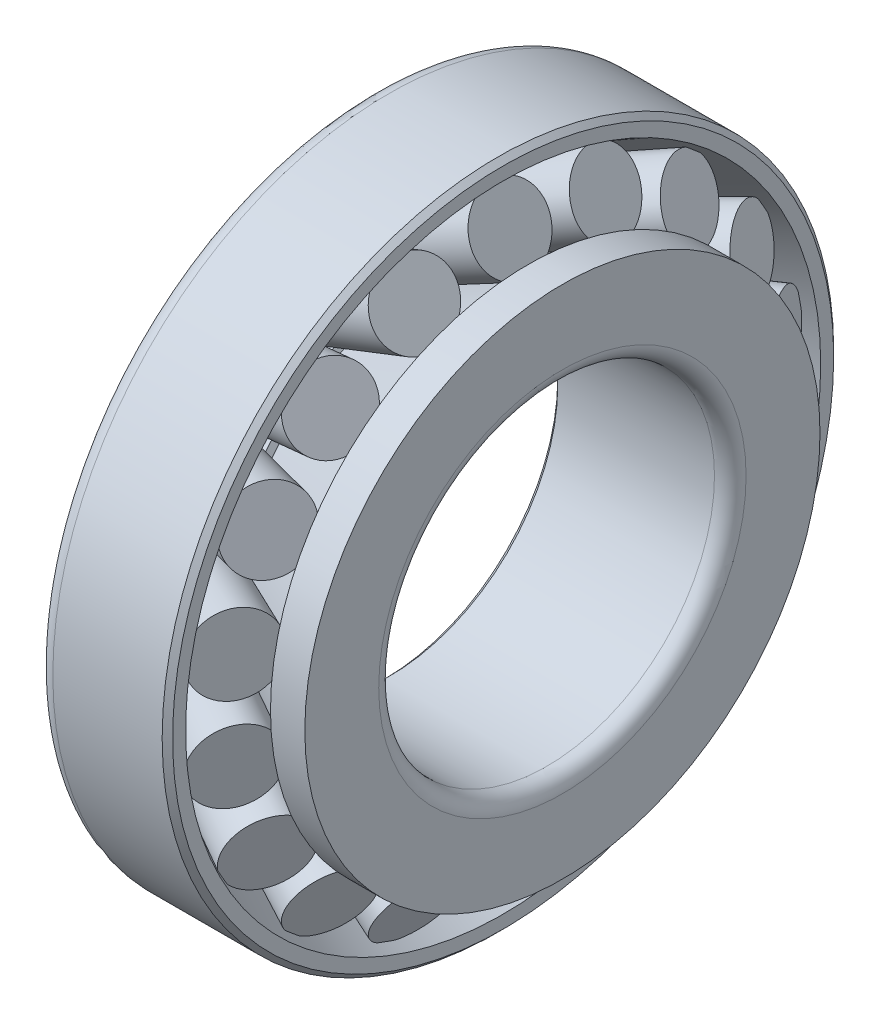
SolidWorks part; units mm, degrees
revolve "OuterRace" add sketch "OutRacSke" angle 360 about L5
sketch "OutRacSke" plane through (0, 0, 0) normal (0, 0, 1) x (1, 0, 0)
  line L0 (-15, 80.39) -> (-48, 62.814)
  line L1 (-48, 62.814) -> (-48, 81)
  line L2 (-44, 85) -> (-16.32, 85)
  line L3 (-16.32, 85) -> (-15, 83.68)
  line L4 (-15, 83.68) -> (-15, 80.39)
  line L5 (-42.5, 0) -> (42.5, 0) construction
  arc A0 (-48, 81) -> (-44, 85) centre (-44, 81) cw
ref_plane "Plane1" through (0, 0, 0) normal (0, 0, 1) x (1, 0, 0)
ref_plane "Plane2" through (0, 0, 0) normal (0, 1, 0) x (1, 0, 0)
ref_plane "Plane3" through (0, 0, 0) normal (1, 0, 0) x (0, 0, -1)
sketch "Clipboard" plane through (0, 0, 0) normal (0, 0, 1) x (1, 0, 0)
  line L0 (0, 0) -> (10, 0) construction
  line L1 (0, 0) -> (119.4793, -38.8212)
  line L2 (0, 0) -> (73.6122, 42.5)
  line L3 (0, 0) -> (147.2243, -85)
  line L4 (0, 0) -> (-29.6819, -1.0365)
  line L5 (0, 0) -> (-19.25, 48)
sketch "RolDetSke" plane through (0, 0, 0) normal (0, 0, 1) x (1, 0, 0)
  line L0 (-39.4754, 56.7739) -> (-44, 65.2691)
  line L1 (-39.4754, 56.7739) -> (-13.2616, 70.7355)
  line L2 (-17.7862, 79.2308) -> (-13.2616, 70.7355)
  line L4 (-49.0629, 51.6676) -> (-2.2918, 76.5781) construction
  line L5 (-17.7862, 79.2308) -> (-44, 65.2691)
  line L9 (-15, 80.39) -> (-48, 62.814) construction
revolve "RollerDetailed" add sketch "RolDetSke" angle 360 about L4
sketch "RolSimSke" plane through (0, 0, 0) normal (0, 0, 1) x (1, 0, 0)
  line L0 (0, 0) -> (-32, 0) construction
  line L1 (-44, 65.2691) -> (-17.7862, 79.2308)
  line L2 (-44, 65.2691) -> (-34.9508, 48.2787)
  line L3 (-34.9508, 48.2787) -> (-8.737, 62.2403)
  line L4 (-17.7862, 79.2308) -> (-8.737, 62.2403)
revolve "RollersSimplified" [suppressed] add sketch "RolSimSke" angle 360 about L0
ref_axis "Axis1" through (-50, 0, 0) along (1, 0, 0)
pattern_circular "RollersDetailed" count 18 every 20 about axis through (-50, 0, 0) along (1, 0, 0) of "RollerDetailed", "OuterRace"
sketch "InsRacSke" plane through (0, 0, 0) normal (0, 0, 1) x (1, 0, 0)
  line L0 (-35.6965, 49.7637) -> (-45, 49.7637)
  line L1 (-48, 81) -> (-48, -81) construction
  line L2 (-45, 49.7637) -> (-45, 43.82)
  line L3 (-45, 43.82) -> (-43.68, 42.5)
  line L4 (-43.68, 42.5) -> (-4, 42.5)
  line L5 (0, 46.5) -> (0, 65.2103)
  line L6 (0, 65.2103) -> (-8.6918, 65.2103)
  line L7 (-8.6918, 65.2103) -> (-8.6918, 62.2403)
  line L8 (-8.6918, 62.2403) -> (-34.9056, 48.2787)
  line L9 (-34.9056, 48.2787) -> (-35.6965, 49.7637)
  line L10 (-42.5, 0) -> (42.5, 0) construction
  arc A0 (-4, 42.5) -> (0, 46.5) centre (-4, 46.5) ccw
revolve "InnerRace" add sketch "InsRacSke" angle 360 about L10
sketch "CagSpiSke" plane through (0, 0, 0) normal (0, 0, 1) x (1, 0, 0)
  line L3 (-11.9509, 71.1089) -> (-39.4754, 56.4492)
  line L4 (-40.0048, 54.7132) -> (-38.7983, 52.4478)
  line L6 (-42.5, 0) -> (42.5, 0) construction
  arc A1 (-39.4754, 56.4492) -> (-40.0048, 54.7132) centre (-38.8721, 55.3165) ccw
revolve "CageSpine" [suppressed] add sketch "CagSpiSke" angle 360 about L6
equation "\"OD@OutRacSke\" = \"Race_OD@Clipboard\""
equation "\"cup_SID@OutRacSke\" = \"Race_ID@Clipboard\""
equation "\"chamfer@OutRacSke\" = \"cup_width@OutRacSke\" / 25"
equation "\"offset@OutRacSke\" = \"OA_width@Clipboard\""
equation "\"D2@RolDetSke\" = \"offset@OutRacSke\" - \"cup_radius@OutRacSke\""
equation "\"dy@RolDetSke\" =  ( ( \"Race_ID@Clipboard\" / 2 ) + ( \"cup_radius@OutRacSke\" ) * tan(\"Tangle@OutRacSke\" * 3.141592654/180) ) * 1.005"
equation "\"cyl_len@RolDetSke\" = \"cyl_len@Clipboard\""
equation "\"Roller_diameter@RolDetSke\" = \"Roller_diameter@Clipboard\""
equation "\"dx@RolSimSke\" = \"offset@OutRacSke\" - \"cup_radius@OutRacSke\""
equation "\"dy@RolSimSke\" =  ( ( \"Race_ID@Clipboard\" / 2 ) + ( \"cup_radius@OutRacSke\" ) * tan(\"Tangle@OutRacSke\" * 3.141592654/180) ) * 1.005"
equation "\"Cyl_Len@RolSimSke\" = \"cyl_len@Clipboard\""
equation "\"Roller_diameter@RolSimSke\" = \"Roller_diameter@Clipboard\""
equation "\"Bore@InsRacSke\" = \"Bore@Clipboard\""
equation "\"Tangle@InsRacSke\" = \"Tangle@OutRacSke\""
equation "\"cyl_len@InsRacSke\" = \"cyl_len@Clipboard\""
equation "\"chamfer@InsRacSke\" = \"chamfer@OutRacSke\""
equation "\"D2@InsRacSke\" = \"OA_width@Clipboard\""
equation "\"dx@InsRacSke\" = \"offset@OutRacSke\" - \"cup_radius@OutRacSke\" -  (  \"Roller_diameter@Clipboard\" * 1.005 )  * sin(\"Tangle@InsRacSke\" * 3.141592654/180)"
equation "\"dy@InsRacSke\" = ( ( \"Race_ID@Clipboard\" / 2 ) + ( \"cup_radius@OutRacSke\" ) * tan(\"Tangle@OutRacSke\" * 3.141592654/180) ) * 1.005 -  ( \"Roller_diameter@Clipboard\" )  * cos(\"Tangle@InsRacSke\" * 3.14159"
equation "\"front_groove@InsRacSke\" = \"Groove_dp@InsRacSke\" / 2"
equation "\"Tangle@CagSpiSke\" = \"Tangle@OutRacSke\""
equation "\"dx@CagSpiSke\" = ( \"offset@OutRacSke\" - \"cup_radius@OutRacSke\" ) -  (  \"Roller_diameter@Clipboard\" / 2  )  * sin(\"Tangle@InsRacSke\" * 3.141592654/180)"
equation "\"dy@CagSpiSke\" = ( ( \"Race_ID@Clipboard\" / 2 ) + ( \"cup_radius@OutRacSke\" ) * tan(\"Tangle@OutRacSke\" * 3.141592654/180) )  -  ( \"Roller_diameter@Clipboard\" / 2 )  * cos(\"Tangle@InsRacSke\" * 3.14159265"
equation "\"length@CagSpiSke\" = \"cyl_len@Clipboard\" * 1.05"
equation "\"offset@CagSpiSke\" = \"Roller_diameter@Clipboard\" / 5"
equation "\"radius@CagSpiSke\" = \"offset@CagSpiSke\" / 3"
equation "\"D3@CageSpine\" = \"Roller_diameter@Clipboard\" / 6"
equation "\"Max_count@Clipboard\" = int( 3.14159265 / atn(( \"Roller_diameter@Clipboard\" / 2) / sqr( \"dy@CagSpiSke\"  *  \"dy@CagSpiSke\" - ( \"Roller_diameter@Clipboard\" / 2) *  ( \"Roller_diameter@Clipboard\" / 2))))"
equation "\"Max_count@Clipboard\" = ((sgn( \"Max_count@Clipboard\" - \"Count@Clipboard\" )-1)*( \"Max_count@Clipboard\" - \"Count@Clipboard\" ))/-2+ \"Count@Clipboard\""
equation "\"Count@RollersDetailed\" = int( \"Show_count@Clipboard\" ) "
equation "\"Count@RollersDetailed\" = ((sgn( \"Count@RollersDetailed\" - \"Max_count@Clipboard\" )-1)*( \"Count@RollersDetailed\" - \"Max_count@Clipboard\" ))/-2+ \"Max_count@Clipboard\""
equation "\"Count@RollersDetailed\" = ((sgn( \"Count@RollersDetailed\" - \"Min_count@Clipboard\" )+1)*( \"Count@RollersDetailed\" - \"Min_count@Clipboard\"))/2 +\"Min_count@Clipboard\""
equation "\"Angle@RollersDetailed\" = 360.0 / \"Max_count@Clipboard\""
equation "\"Angle@CageSpine\" =  \"Angle@RollersDetailed\" * ( \"Count@RollersDetailed\" -1 + int( \"Count@RollersDetailed\" / \"Max_count@Clipboard\" ) )  + 0.001 -  int( \"Count@RollersDetailed\" / \"Max_count@Clipboard\" "
equation "\"Angle@CageSpine\" =  \"Angle@CageSpine\" * int( \"Min_count@Clipboard\" / 2) + int(1 / \"Min_count@Clipboard\")  * 0.001"
equation "\"Tangle@RolSimSke\" = \"Tangle@OutRacSke\""
